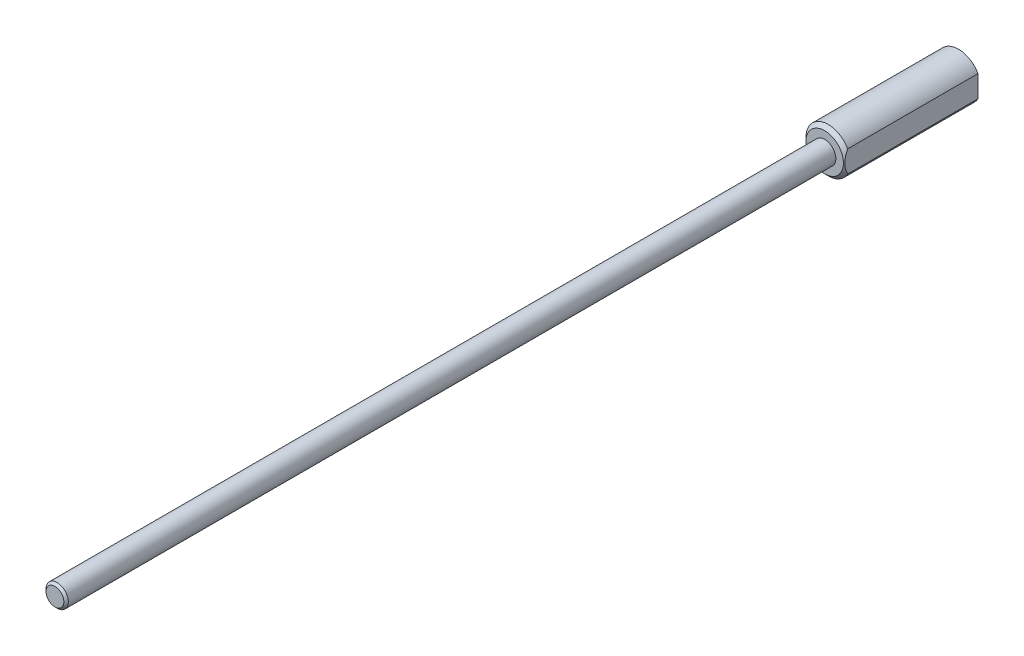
SolidWorks part; units mm, degrees
ref_plane "Front Plane" through (0, 0, 0) normal (0, 0, 1) x (1, 0, 0)
ref_plane "Top Plane" through (0, 0, 0) normal (0, 1, 0) x (1, 0, 0)
ref_plane "Right Plane" through (0, 0, 0) normal (1, 0, 0) x (0, 0, -1)
sketch "Sketch1" plane through (0, 0, 0) normal (0, 0, 1) x (1, 0, 0)
  line L0 (0, 0) -> (0, 6.35) construction
  line L1 (-5.5372, -3.1084) -> (-5.5372, 3.1084)
  line L2 (5.5372, 3.1084) -> (5.5372, -3.1084)
  circle A0 centre (0, 0) radius 3.175
  circle A1 centre (0, 0) radius 6.35
  dimension "D1" = 6.35
  dimension "D2" = 12.7
  dimension "D3" = 11.0744
sketch "Sketch2" plane through (0, 0, 0) normal (0, 0, 1) x (1, 0, 0)
  circle A0 centre (0, 0) radius 3.175 construction
  circle A1 centre (0, 0) radius 6.35 construction
  circle A2 centre (0, 0) radius 3.175
  circle A3 centre (0, 0) radius 6.35
extrude "Boss-Extrude1" add sketch "Sketch2" along normal blind 38.1
chamfer "Chamfer1" distance 1.016 angle 45 1 edges at (6.35, 0, 38.1)
sketch "Sketch3" plane through (0, 0, 0) normal (0, 0, 1) x (1, 0, 0)
  line L0 (5.5372, 3.1084) -> (5.5372, -3.1084) construction
  line L1 (5.5372, 3.1084) -> (5.5372, -3.1084)
extrude "Cut-Extrude1" cut sketch "Sketch3" against normal through all and the other way through all
sketch "Sketch4" plane through (0, 0, 0) normal (0, 0, 1) x (1, 0, 0)
  circle A0 centre (0, 0) radius 3.175 construction
  circle A1 centre (0, 0) radius 3.175
extrude "Boss-Extrude2" add sketch "Sketch4" along normal blind 238.125 from offset 19.05 separate body
chamfer "Chamfer2" distance 0.635 angle 45 1 edges at (3.175, 0, 257.175)
